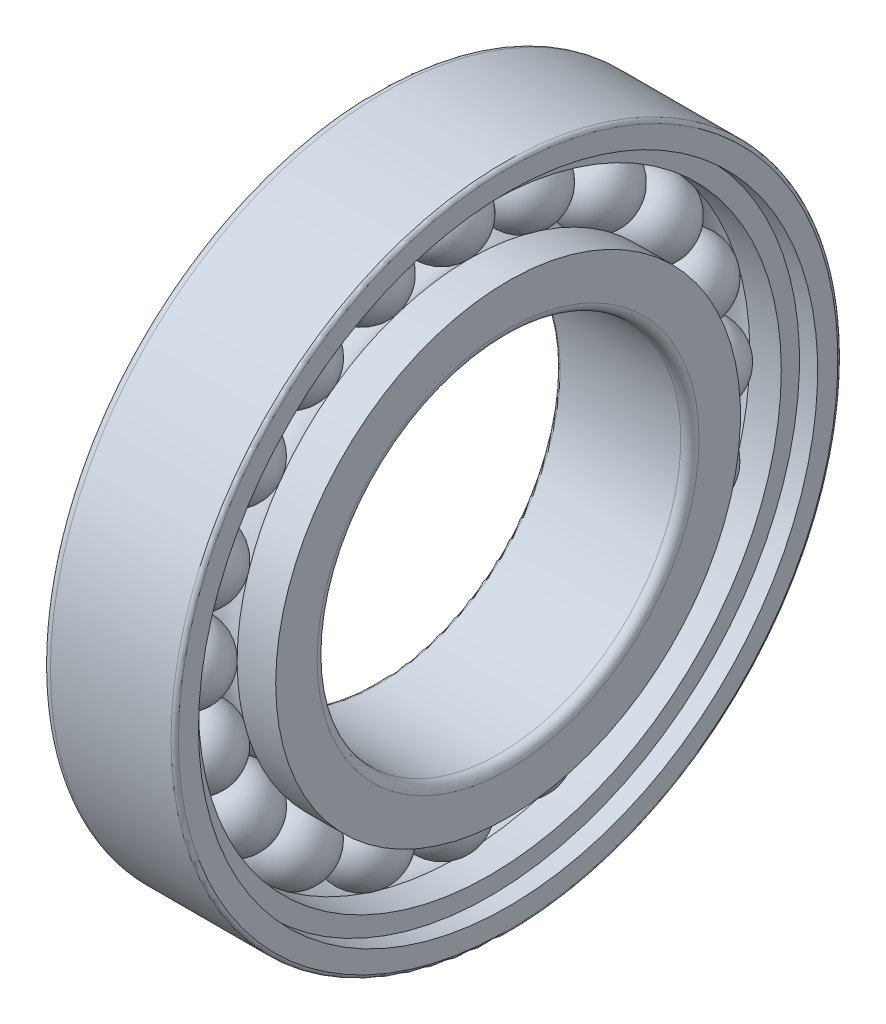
SolidWorks part; units mm, degrees
ref_plane "Front" through (0, 0, 0) normal (0, 0, 1) x (1, 0, 0)
ref_plane "Top" through (0, 0, 0) normal (0, 1, 0) x (1, 0, 0)
ref_plane "Right" through (0, 0, 0) normal (1, 0, 0) x (0, 0, -1)
sketch "Sketch1" plane through (0, 0, 0) normal (0, 0, 1) x (1, 0, 0)
  line L0 (-3.0919, 0) -> (2.899, 0) construction
  line L1 (-3.0919, 42.5) -> (2.899, 42.5) construction
  line L2 (-6.25, 42.5) -> (6.25, 42.5)
  arc A0 (-6.25, 42.5) -> (6.25, 42.5) centre (0, 42.5) ccw
revolve "Revolve1" add sketch "Sketch1" angle 360 about L1
sketch "Sketch2" plane through (0, 0, 0) normal (0, 0, 1) x (1, 0, 0)
  line L0 (-11, 38.3333) -> (-4.645, 38.3333)
  line L1 (11, 38.3333) -> (11, 30)
  line L2 (11, 30) -> (-11, 30)
  line L3 (-11, 30) -> (-11, 38.3333)
  line L4 (-2.9924, 0) -> (3.9982, 0) construction
  line L5 (-1.8743, 42.5) -> (3.1755, 42.5) construction
  line L7 (4.645, 38.3333) -> (11, 38.3333)
  line L8 (-11, 6.2861) -> (-11, 1.454) construction
  arc A0 (-4.645, 38.3333) -> (4.645, 38.3333) centre (0, 42.5) ccw
revolve "Revolve2" add sketch "Sketch2" angle 360 about L4
sketch "Sketch3" plane through (0, 0, 0) normal (0, 0, 1) x (1, 0, 0)
  line L0 (-11, 46.6667) -> (-11, 55)
  line L1 (-11, 55) -> (11, 55)
  line L2 (11, 55) -> (11, 51.0667)
  line L3 (8, 48.0667) -> (2.8195, 48.0667)
  line L4 (-2.9924, 0) -> (3.4329, 0) construction
  line L6 (-1.7375, 42.5) -> (2.2712, 42.5) construction
  line L7 (-4.645, 46.6667) -> (-11, 46.6667)
  line L8 (8, 48.0667) -> (8, 51.0667)
  line L9 (8, 51.0667) -> (11, 51.0667)
  arc A0 (2.8195, 48.0667) -> (-4.645, 46.6667) centre (0, 42.5) ccw
revolve "Revolve3" add sketch "Sketch3" angle 360 about L4
pattern_circular "Circular-Pattern1" count 20 over 360 about axis through (0, 0, 0) along (1, 0, 0) of "Revolve1"
fillet "Fillet1" radius 1.5 2 edges at (11, 0, 30) (-11, 0, 55)
fillet "Fillet2" radius 0.6 2 edges at (11, 0, 55) (-11, 0, 30)
equation "\"R@Sketch1\" =  ( \"DD@Sketch3\" - \"d@Sketch2\" )  / 8"
equation "\"D1@Sketch1\"=(\"d@Sketch2\"+\"DD@Sketch3\")/4"
equation "\"D1@Sketch2\"=(\"d@Sketch2\"+\"DD@Sketch3\")/4"
equation "\"D3@Sketch2\" =  \"d@Sketch2\"+  ( \"DD@Sketch3\" - \"d@Sketch2\" )  /3"
equation "\"D2@Sketch2\" =  ( \"DD@Sketch3\" - \"d@Sketch2\" )  / 8 - 0.01"
equation "\"D6@Sketch2\" = \"B@Sketch2\" / 2"
equation "\"B@Sketch3\" = \"B@Sketch2\""
equation "\"D2@Sketch3\" = \"B@Sketch3\" / 2"
equation "\"D1@Sketch3\"=(\"d@Sketch2\"+\"DD@Sketch3\")/4"
equation "\"D3@Sketch3\" = (  \"DD@Sketch3\" -  (\"DD@Sketch3\" - \"d@Sketch2\"  )  / 3 )  * 1.03"
equation "\"D5@Sketch3\" = \"DD@Sketch3\" -  (  \"DD@Sketch3\" - \"d@Sketch2\")  / 3"
equation "\"D6@Sketch3\" = \"d@Sketch2\" / 20"
equation "\"D7@Sketch3\"=\"D6@Sketch3\""
equation "\"D4@Sketch3\"=(\"DD@Sketch3\"-\"d@Sketch2\")/8-0.01"
equation "\"m@Circular-Pattern1\" = int( 3.14159265 / atn(\"R@Sketch1\" / sqr((\"d@Sketch2\"+\"DD@Sketch3\")/4 * (\"d@Sketch2\"+\"DD@Sketch3\")/4 - \"R@Sketch1\" *  \"R@Sketch1\")))-1"
